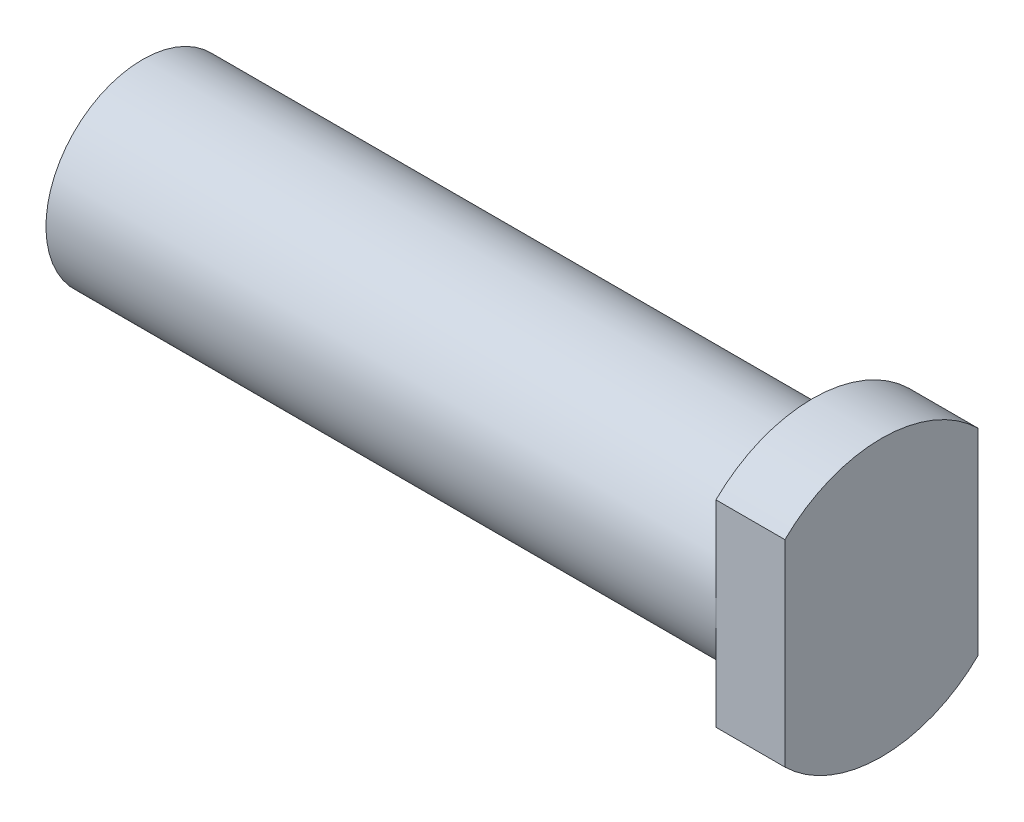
SolidWorks part; units mm, degrees
ref_plane "Plan de face" through (0, 0, 0) normal (0, 0, 1) x (1, 0, 0)
ref_plane "Plan de dessus" through (0, 0, 0) normal (0, 1, 0) x (1, 0, 0)
ref_plane "Plan de droite" through (0, 0, 0) normal (1, 0, 0) x (0, 0, -1)
sketch "Esquisse1" plane through (0, 0, 0) normal (0, 0, 1) x (1, 0, 0)
  line L0 (0, 0) -> (0, 7)
  line L1 (0, 7) -> (48.5778, 7)
  line L2 (48.5778, 7) -> (48.5778, 10)
  line L3 (48.5778, 10) -> (53.5778, 10)
  line L4 (53.5778, 10) -> (53.5778, 0)
  line L5 (53.5778, 0) -> (0, 0)
  dimension "D1" = 7
  dimension "D2" = 5
  dimension "D3" = 3
revolve "Révolution1" add sketch "Esquisse1" angle 360 about L5
ref_point "Point1"
sketch "Esquisse2" plane through (0, 0, 0) normal (-1, 0, 0) x (0, 0, 1)
  point P0 (0, 0)
sketch "Esquisse3" plane through (0, 0, 0) normal (0, 1, 0) x (1, 0, 0)
  line L0 (53.5778, -10) -> (53.5778, 10) construction
  line L1 (47.5778, 15.4186) -> (54.5778, 15.4186)
  line L2 (47.5778, 15.4186) -> (47.5778, 7)
  line L3 (47.5778, 7) -> (54.5778, 7)
  line L4 (54.5778, 15.4186) -> (54.5778, 7)
  line L5 (47.5778, -16.1615) -> (54.5778, -16.1615)
  line L6 (47.5778, -16.1615) -> (47.5778, -7)
  line L7 (47.5778, -7) -> (54.5778, -7)
  line L8 (54.5778, -16.1615) -> (54.5778, -7)
  line L9 (48.5778, 10) -> (48.5778, -10) construction
  point P8 (53.5778, 0)
  dimension "D1" = 14
  dimension "D2" = 7
  dimension "D3" = 0
  dimension "D4" = 1
  dimension "D5" = 0
  dimension "D6" = 1
extrude "Enlèv. mat.-Extru.1" cut sketch "Esquisse3" against normal through all and the other way through all
